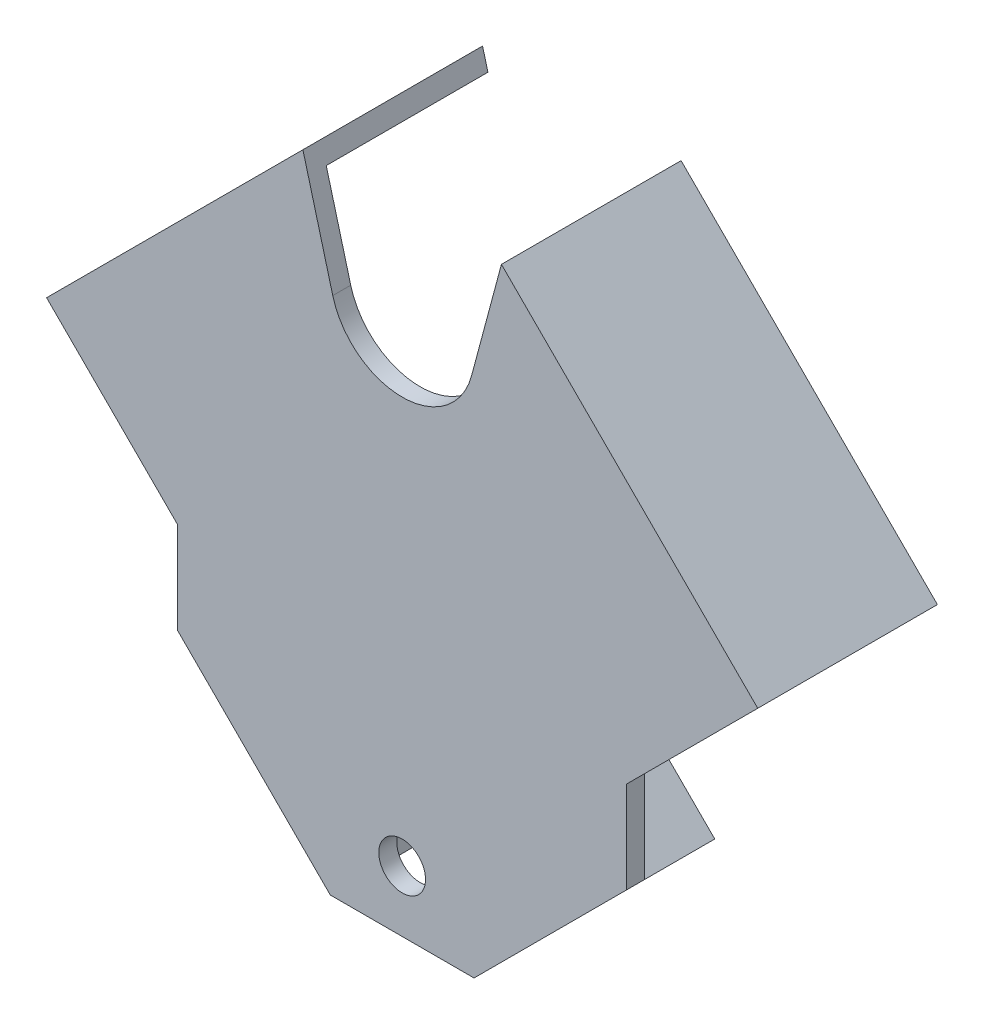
SolidWorks part; units mm, degrees
ref_plane "Front Plane" through (0, 0, 0) normal (0, 0, 1) x (1, 0, 0)
ref_plane "Top Plane" through (0, 0, 0) normal (0, 1, 0) x (1, 0, 0)
ref_plane "Right Plane" through (0, 0, 0) normal (1, 0, 0) x (0, 0, -1)
sketch "Sketch1" plane through (0, 0, 0) normal (0, 0, 1) x (1, 0, 0)
  line L0 (-582.4235, 0) -> (28538.7533, 0) construction
  line L1 (0, -582.4235) -> (0, 28538.7533) construction
  line L2 (62.5, 42.5) -> (20, 0)
  line L3 (-19.3185, 144.8236) -> (-26.1301, 170.2446)
  line L4 (0, 203.4457) -> (-98.9621, 104.4837) construction
  line L5 (-95.4265, 100.9482) -> (-62.5, 68.0216)
  line L6 (-62.5, 68.0216) -> (-62.5, 42.5)
  line L7 (-62.5, 42.5) -> (-20, 0)
  line L8 (-20, 0) -> (20, 0)
  line L9 (62.5, 68.0216) -> (62.5, 42.5)
  line L10 (95.4265, 100.9482) -> (62.5, 68.0216)
  line L11 (0, 203.4457) -> (98.9621, 104.4837) construction
  line L12 (19.3185, 144.8236) -> (26.1301, 170.2446)
  line L13 (-98.9621, 104.4837) -> (0, 203.4457) construction
  line L14 (-26.1301, 170.2446) -> (-95.4265, 100.9482)
  line L15 (26.1301, 170.2446) -> (95.4265, 100.9482)
  line L16 (-27.6243, 175.8214) -> (-98.9621, 104.4837) construction
  line L17 (-24.0888, 172.2859) -> (-95.4265, 100.9482) construction
  line L18 (-3.5355, 199.9102) -> (95.4265, 100.9482) construction
  arc A0 (-19.3185, 144.8236) -> (19.3185, 144.8236) centre (0, 150) ccw
  circle A1 centre (0, 17) radius 6.5
  point P7 (0, 0)
  dimension "D3" = 20
  dimension "D9" = 13
  dimension "D1" = 20
  dimension "D2" = 158
  dimension "D4" = 62.5
  dimension "D5" = 98
  dimension "D6" = 60
  dimension "D7" = 42.5
  dimension "D8" = 150
  dimension "D10" = 17
  dimension "D11" = 5
  dimension "D12" = 5
extrude "Boss-Extrude1" add sketch "Sketch1" along normal mid plane 5
sketch "Sketch2" plane through (0, 0, -2.5) normal (0, 0, -1) x (-1, 0, 0)
  line L0 (-26.1301, 170.2446) -> (-95.4265, 100.9482)
  line L1 (-95.4265, 100.9482) -> (-98.9621, 104.4837)
  line L2 (-98.9621, 104.4837) -> (-27.6243, 175.8214)
  line L3 (-26.1301, 170.2446) -> (-27.6243, 175.8214)
  line L4 (-26.1301, 170.2446) -> (-19.3185, 144.8236) construction
  line L5 (0, -1000) -> (0, 49000) construction
  line L6 (95.4265, 100.9482) -> (98.9621, 104.4837)
  line L7 (26.1301, 170.2446) -> (27.6243, 175.8214)
  line L8 (98.9621, 104.4837) -> (27.6243, 175.8214)
  line L9 (26.1301, 170.2446) -> (95.4265, 100.9482)
  dimension "D1" = 5
extrude "Boss-Extrude2" add sketch "Sketch2" along normal blind 45 and the other way blind 5
sketch "Sketch3" plane through (0, 0, -2.5) normal (0, 0, -1) x (-1, 0, 0)
  line L0 (-1000, 0) -> (49000, 0) construction
  line L1 (0, -1000) -> (0, 49000) construction
  line L2 (-20, 0) -> (-37, 17)
  line L3 (-20, 0) -> (-62.5, 42.5) construction
  line L4 (-37, 17) -> (-7.0711, 46.9289)
  line L5 (7.0711, 46.9289) -> (37, 17)
  line L6 (62.5, 42.5) -> (20, 0) construction
  line L7 (37, 17) -> (20, 0)
  line L8 (-20, 7.0711) -> (-29.9289, 17)
  line L9 (-29.9289, 17) -> (-3.5355, 43.3934)
  line L10 (3.5355, 43.3934) -> (29.9289, 17)
  line L11 (29.9289, 17) -> (20, 7.0711)
  line L12 (-20, 0) -> (-20, 7.0711)
  line L13 (20, 0) -> (20, 7.0711)
  line L15 (-16.4645, 3.5355) -> (-29.9289, 17) construction
  line L16 (29.9289, 17) -> (16.4645, 3.5355) construction
  arc A0 (-7.0711, 46.9289) -> (7.0711, 46.9289) centre (0, 39.8579) cw
  arc A1 (-3.5355, 43.3934) -> (3.5355, 43.3934) centre (0, 39.8579) cw
  point P18 (0, 54)
  dimension "D2" = 10
  dimension "D1" = 17
  dimension "D3" = 5
extrude "Boss-Extrude3" add sketch "Sketch3" along normal up to surface (45 mm away)
sketch "Sketch4" plane through (0, 0, 0) normal (1, 0, 0) x (0, 0, -1)
  line L0 (14.5, 45) -> (14.5, 49.8579)
  line L1 (14.5, 49.8579) -> (30.5, 49.8579)
  line L2 (30.5, 49.8579) -> (30.5, 45)
  line L3 (47.5, 0) -> (2.5, 0) construction
  line L4 (2.5, 46.9289) -> (2.5, 17) construction
  line L5 (47.5, 49.8579) -> (2.5, 49.8579) construction
  arc A0 (14.5, 45) -> (30.5, 45) centre (22.5, 45) ccw
  dimension "D2" = 8
  dimension "D1" = 45
  dimension "D3" = 20
extrude "Cut-Extrude1" cut sketch "Sketch4" against normal through all both and the other way through all
fillet "Fillet1" radius 3 2 edges at (-29.9289, 17, -25) (29.9289, 17, -25)
